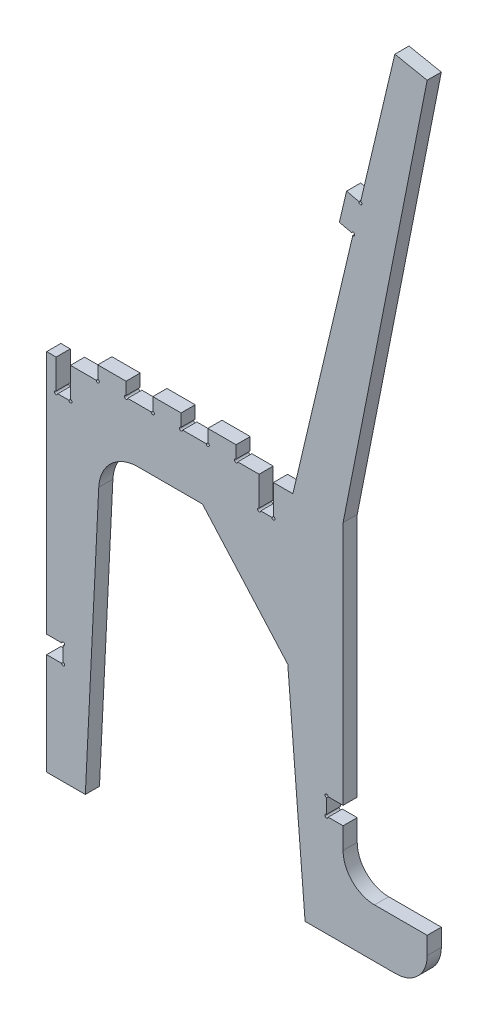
SolidWorks part; units mm, degrees
ref_plane "Front Plane" through (0, 0, 0) normal (0, 0, 1) x (1, 0, 0)
ref_plane "Top Plane" through (0, 0, 0) normal (0, 1, 0) x (1, 0, 0)
ref_plane "Right Plane" through (0, 0, 0) normal (1, 0, 0) x (0, 0, -1)
sketch "Sketch3" plane through (0, 0, -44.5) normal (0, 0, 1) x (1, 0, 0)
  line L0 (167.9594, -45.8811) -> (276.503, -168.141)
  line L1 (386.8602, -378.1034) -> (453.868, -378.1034)
  line L2 (-30.2551, 22.9994) -> (-30.2551, -440.4377)
  line L3 (-30.2551, -440.4377) -> (18.9333, -440.4377)
  line L4 (18.9333, -440.4377) -> (35.9995, -93.425)
  line L5 (85.9391, -45.8811) -> (167.9594, -45.8811)
  line L6 (276.503, -168.141) -> (298.5341, -440.4377)
  line L7 (298.5341, -440.4377) -> (346.8602, -440.4377)
  line L8 (346.8602, -338.1034) -> (346.8602, 22.9994)
  line L9 (346.8602, 22.9994) -> (453.868, 564.0542)
  line L10 (453.868, 564.0542) -> (412.7093, 572.1944)
  line L11 (412.7093, 572.1944) -> (283.0008, 22.9994)
  line L12 (283.0008, 22.9994) -> (-30.2551, 22.9994)
  line L13 (453.868, -378.1034) -> (453.868, -400.4377)
  line L14 (413.868, -440.4377) -> (346.8602, -440.4377)
  line L15 (453.868, 564.0542) -> (453.868, -529.5761) construction
  arc A0 (35.9995, -93.425) -> (85.9391, -45.8811) centre (85.9391, -95.8811) cw
  arc A1 (453.868, -400.4377) -> (413.868, -440.4377) centre (413.868, -400.4377) cw
  arc A2 (386.8602, -378.1034) -> (346.8602, -338.1034) centre (386.8602, -338.1034) cw
  dimension "D1" = 50
  dimension "D2" = 40
extrude "Boss-Extrude1" add sketch "Sketch3" along normal blind 18
sketch "Sketch4" plane through (0, 0, -26.5) normal (0, 0, 1) x (1, 0, 0)
  line L0 (0, 53.8513) -> (0, -16.3906)
  line L2 (0, -16.3906) -> (-18.2, -16.3906)
  line L3 (-18.2, -16.3906) -> (-18.2, 53.8513)
  line L4 (-18.2, 53.8513) -> (0, 53.8513)
  line L5 (283.0008, 22.9994) -> (-30.2551, 22.9994) construction
  dimension "D1" = 39.39
  dimension "D2" = 18.2
extrude "Cut-Extrude1" cut sketch "Sketch4" against normal up to next
sketch "Sketch5" plane through (0, 0, -26.5) normal (0, 0, 1) x (1, 0, 0)
  line L0 (258.2, 22.9994) -> (258.2, -16.3906)
  line L2 (258.2, -16.3906) -> (240, -16.3906)
  line L3 (240, -16.3906) -> (240, 22.9994)
  line L5 (-18.2, -16.3906) -> (0, -16.3906) construction
  line L6 (0, -16.3906) -> (0, 22.9994) construction
  dimension "D1" = 18.2
  dimension "D2" = 240
extrude "Cut-Extrude2" cut sketch "Sketch5" against normal through all and the other way through all flip side to cut
sketch "Sketch7" plane through (0, 0, -26.5) normal (0, 0, 1) x (1, 0, 0)
  line L0 (240, 22.9994) -> (0, 22.9994) construction
  line L1 (34.7449, 22.9994) -> (70.7449, 22.9994)
  line L2 (34.7449, 22.9994) -> (34.7449, 40.8994)
  line L3 (34.7449, 40.8994) -> (70.7449, 40.8994)
  line L4 (70.7449, 22.9994) -> (70.7449, 40.8994)
  line L5 (-30.2551, 22.9994) -> (-30.2551, -440.4377) construction
  point P8 (34.7449, 31.9494)
  dimension "D1" = 17.9
  dimension "D2" = 36
  dimension "D3" = 65
extrude "Boss-Extrude3" add sketch "Sketch7" against normal up to surface (18 mm away)
pattern_linear "LPattern1" count 3 spacing 70 along (1, 0, 0) of "Boss-Extrude3"
sketch "Sketch10" plane through (0, 0, -26.5) normal (0, 0, 1) x (1, 0, 0)
  line L0 (368.8525, 386.5015) -> (359.6583, 347.5725)
  line L2 (359.6583, 347.5725) -> (342.1402, 351.7099)
  line L3 (342.1402, 351.7099) -> (351.3344, 390.6389)
  line L5 (368.8525, 386.5015) -> (351.3344, 390.6389)
  dimension "D1" = 40
  dimension "D2" = 18
extrude "Boss-Extrude4" add sketch "Sketch10" against normal up to surface (18 mm away) contours L5 L0 L2 L3
sketch "Sketch11" plane through (-30.2551, 0, 0) normal (-1, 0, 0) x (0, 0, 1)
  line L0 (-44.7718, -288.4309) -> (-26.2718, -288.4309)
  line L1 (-26.2718, -288.4309) -> (-26.2718, -310.9309)
  line L2 (-26.2718, -310.9309) -> (-44.7718, -310.9309)
  line L3 (-44.7718, -310.9309) -> (-44.7718, -288.4309)
  line L4 (-26.5, 22.9994) -> (-26.5, -440.4377) construction
  line L5 (-35.5218, -282.1613) -> (-35.5218, -321.8244) construction
  dimension "D1" = 22.5
  dimension "D2" = 18.5
extrude "Cut-Extrude3" cut sketch "Sketch11" against normal blind 21
sketch "Sketch12" plane through (346.8602, 0, 0) normal (1, 0, 0) x (0, 0, -1)
  line L0 (26.5, -288.4309) -> (44.5, -288.4309)
  line L1 (44.5, -288.4309) -> (44.5, -310.9309)
  line L2 (44.5, -310.9309) -> (26.5, -310.9309)
  line L3 (26.5, -310.9309) -> (26.5, -288.4309)
extrude "Cut-Extrude4" cut sketch "Sketch12" against normal blind 21
sketch "Sketch13" plane through (0, 0, -26.5) normal (0, 0, 1) x (1, 0, 0)
  circle A0 centre (-18.2, -16.3906) radius 2
  circle A1 centre (0, -16.3906) radius 2
  circle A2 centre (240, -16.3906) radius 2
  circle A3 centre (258.2, -16.3906) radius 2
  circle A4 centre (34.7449, 22.9994) radius 2
  circle A5 centre (70.7449, 22.9994) radius 2
  circle A6 centre (104.7449, 22.9994) radius 2
  circle A7 centre (140.7449, 22.9994) radius 2
  circle A8 centre (174.7449, 22.9994) radius 2
  circle A9 centre (210.7449, 22.9994) radius 2
  circle A10 centre (359.6583, 347.5725) radius 2
  circle A11 centre (368.8525, 386.5015) radius 2
  circle A12 centre (-9.2551, -288.4309) radius 2
  circle A13 centre (-9.2551, -310.9309) radius 2
  circle A14 centre (325.8602, -288.4309) radius 2
  circle A15 centre (325.8602, -310.9309) radius 2
  dimension "D1" = 4
extrude "Cut-Extrude5" cut sketch "Sketch13" against normal up to next
